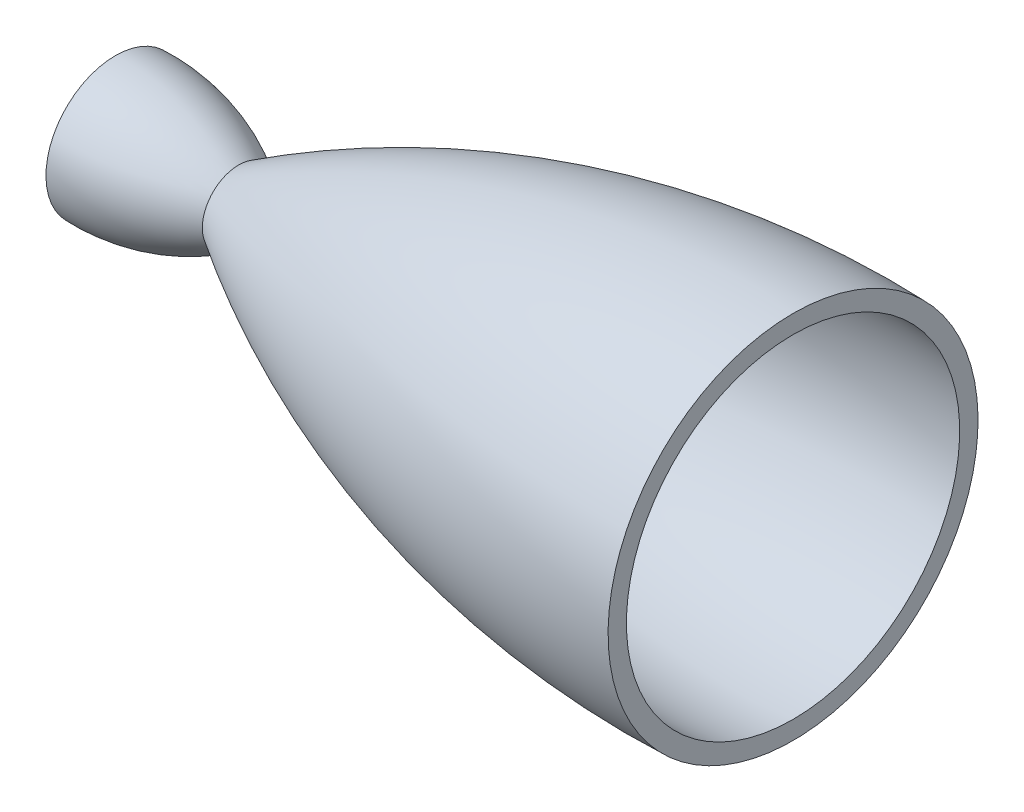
SolidWorks part; units mm, degrees
ref_plane "Front Plane" through (0, 0, 0) normal (0, 0, 1) x (1, 0, 0)
ref_plane "Top Plane" through (0, 0, 0) normal (0, 1, 0) x (1, 0, 0)
ref_plane "Right Plane" through (0, 0, 0) normal (1, 0, 0) x (0, 0, -1)
sketch "Sketch1" plane through (0, 0, 0) normal (0, 0, 1) x (1, 0, 0)
  line L0 (0, 0) -> (0, -9.8)
  line L1 (0, -9.8) -> (302.1, -9.8)
  line L2 (302.1, -9.8) -> (302.1, 81)
  line L3 (0, -9.8) -> (-67.2, -9.8)
  line L4 (-67.2, -9.8) -> (-67.2, 18)
  line L5 (302.1, -9.8) -> (484.1167, -9.8)
  line L6 (484.1167, -9.8) -> (-283.6098, -9.8)
  line L7 (-67.2, 18) -> (-67.2, 28)
  line L8 (0, 0) -> (0, 10)
  line L9 (302.1, 81) -> (302.1, 91)
  line L10 (302.1, 91) -> (302.1, 81)
  line L11 (-67.2, 28) -> (-67.2, 18)
  arc A0 (-67.2, 18) -> (0, 0) centre (-61.7565, -96.1176) cw
  arc A1 (0, 0) -> (302.1, 81) centre (283.97, -455.2425) cw
  arc A2 (-67.2, 28) -> (0, 10) centre (-63.1292, -91.2425) cw
  arc A3 (0, 10) -> (302.1, 91) centre (285.3423, -450.3607) cw
  dimension "D1" = 9.8
  dimension "D2" = 302.1
  dimension "D3" = 90.8
  dimension "D4" = 67.2
  dimension "D5" = 27.8
  dimension "D6" = 10
revolve "Revolve2" add sketch "Sketch1" angle 360 about L6
